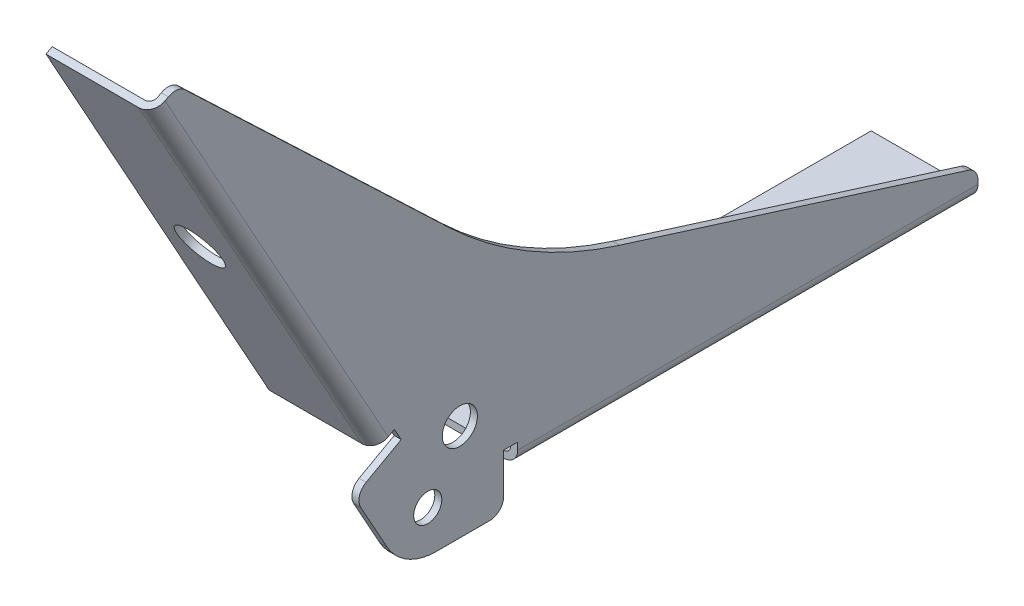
SolidWorks part; units mm, degrees
ref_plane "Plan de face" through (0, 0, 0) normal (0, 0, 1) x (1, 0, 0)
ref_plane "Plan de dessus" through (0, 0, 0) normal (0, 1, 0) x (1, 0, 0)
ref_plane "Plan de droite" through (0, 0, 0) normal (1, 0, 0) x (0, 0, -1)
sketch "Esquisse1" plane through (0, 0, 0) normal (1, 0, 0) x (0, 0, -1)
  line L0 (0, 0) -> (18.1836, 30.8696) construction
  line L1 (13, -1) -> (78.5, -1)
  line L2 (13, -1) -> (13, 0)
  line L3 (13, 0) -> (78.5, 0)
  line L4 (78.5, -1) -> (78.5, 0)
  line L5 (0, 0) -> (61.0543, 0) construction
  line L6 (-7.1771, 10.8852) -> (-6.3025, 11.3701)
  line L7 (-38.9322, 68.1728) -> (-38.0576, 68.6576)
  line L8 (-7.1771, 10.8852) -> (-38.9322, 68.1728)
  line L9 (-6.3025, 11.3701) -> (-38.0576, 68.6576)
  dimension "D1" = 65.5
  dimension "D2" = 1
  dimension "D3" = 59.5
  dimension "D4" = 13
  dimension "D5" = 1
extrude "Boss.-Extru.1" add sketch "Esquisse1" along normal blind 15.2
sketch "Esquisse2" plane through (15.2, 0, 0) normal (1, 0, 0) x (0, 0, -1)
  line L0 (0, 0) -> (30.5098, 51.7954) construction
  line L1 (78.5, 0) -> (13, 0) construction
  line L2 (13, -1) -> (78.5, -1)
  line L3 (13, 0) -> (13, -1) construction
  line L4 (13, -1) -> (78.5, -1) construction
  line L5 (78.5, -1) -> (78.5, 1.5313)
  line L6 (77.0987, 3.4396) -> (27.5, 19)
  line L7 (13, -1) -> (13, 2)
  line L8 (13, 2) -> (11, 2)
  line L9 (11, 2) -> (11, -3.7)
  line L10 (0, 0) -> (-5.9071, -10.0282) construction
  line L11 (9, -5.7) -> (1.3548, -5.7)
  line L12 (-34.3698, 69.0996) -> (3.2855, 33.2634)
  line L13 (-38.9322, 68.1728) -> (-36.7182, 69.4001)
  line L14 (-7.1771, 10.8852) -> (-38.9322, 68.1728)
  line L15 (-7.1771, 10.8852) -> (-4.5533, 12.3397)
  line L16 (-4.5533, 12.3397) -> (-3.5837, 10.5904)
  line L17 (-3.5837, 10.5904) -> (-8.569, 7.827)
  line L18 (-9.3486, 5.1082) -> (-5.6422, -1.5785)
  arc A0 (3.2855, 33.2634) -> (27.5, 19) centre (46.0831, 78.2335) ccw
  arc A1 (-34.3698, 69.0996) -> (-36.7182, 69.4001) centre (-35.7486, 67.6508) ccw
  arc A2 (78.5, 1.5313) -> (77.0987, 3.4396) centre (76.5, 1.5313) ccw
  arc A3 (-8.569, 7.827) -> (-9.3486, 5.1082) centre (-7.5994, 6.0778) ccw
  arc A4 (11, -3.7) -> (9, -5.7) centre (9, -3.7) cw
  arc A5 (1.3548, -5.7) -> (-5.6422, -1.5785) centre (1.3548, 2.3) cw
  circle A6 centre (0.1952, 0.3314) radius 2
  circle A7 centre (4.7631, 8.0861) radius 2.5
  point P14 (78.5, 0.2657)
  point P22 (-37.8252, 68.7864)
  point P30 (-35.4337, 70.1121)
  point P33 (78.5, 3)
  point P36 (-10.3182, 6.8574)
  point P39 (11, -5.7)
  point P42 (-3.3576, -5.7)
  dimension "D8" = 2
  dimension "D9" = 2
  dimension "D10" = 8
  dimension "D11" = 7
  dimension "D12" = 4
  dimension "D13" = 5
  dimension "D1" = 59.5
  dimension "D2" = 4
  dimension "D3" = 51
  dimension "D4" = 16
  dimension "D5" = 2
  dimension "D6" = 3
  dimension "D7" = 7.7
  dimension "D14" = 16
extrude "Boss.-Extru.2" add sketch "Esquisse2" against normal blind 1
fillet "Congé1" radius 2 2 edges at (15.2, 39.529, 23.0547) (15.2, -1, -45.75)
fillet "Congé2" radius 1 2 edges at (14.2, 40.0139, 22.18) (14.2, 0, -45.75)
sketch "Esquisse3" plane through (0, 0, 0) normal (0, 0.4848, -0.8746) x (-1, 0, 0)
  line L0 (0, 13) -> (0, 78.5) construction
  line L1 (-13.2, 78.5) -> (0, 78.5) construction
  circle A0 centre (-6, 45.75) radius 3.3
  dimension "D1" = 6.6
  dimension "D2" = 6
  dimension "D3" = 32.75
extrude "Enlèv. mat.-Extru.1" cut sketch "Esquisse3" against normal through all
sketch "Esquisse4" plane through (0, 0, 0) normal (0, 1, 0) x (1, 0, 0)
  line L0 (0, 78.5) -> (0, 13) construction
  line L2 (13.2, 78.5) -> (0, 78.5) construction
  circle A0 centre (6, 45.75) radius 3.3
  dimension "D1" = 6.6
  dimension "D2" = 6
  dimension "D3" = 32.75
extrude "Enlèv. mat.-Extru.2" cut sketch "Esquisse4" against normal blind 1
